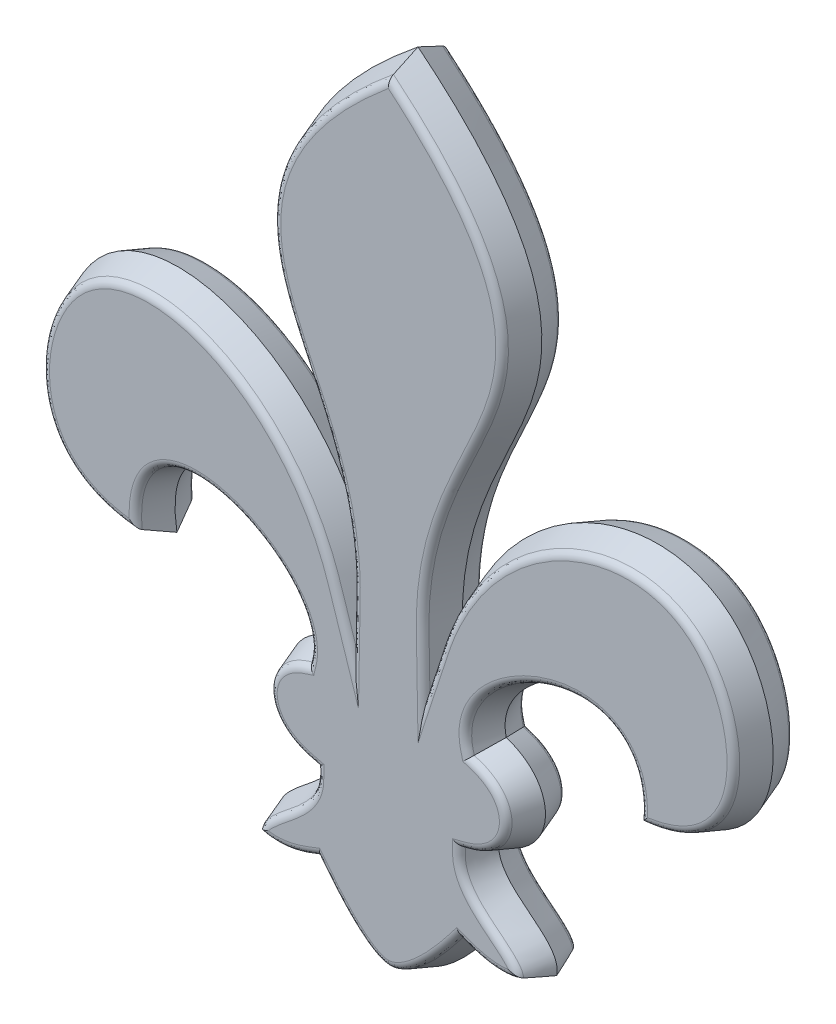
SolidWorks part; units mm, degrees
ref_plane "Front Plane" through (0, 0, 0) normal (0, 0, 1) x (1, 0, 0)
ref_plane "Top Plane" through (0, 0, 0) normal (0, 1, 0) x (1, 0, 0)
ref_plane "Right Plane" through (0, 0, 0) normal (1, 0, 0) x (0, 0, -1)
sketch "Picture" plane through (0, 0, 0) normal (0, 0, 1) x (1, 0, 0)
  line L0 (-0.0772, 107.11) -> (-0.0772, -92.89) construction
  dimension "D1" = 200
sketch "Sketch2" plane through (0, 0, 0) normal (0, 0, 1) x (1, 0, 0)
  line L0 (0, 107) -> (0, -93) construction
  line L1 (11.4926, -93) -> (-11.4926, -93) construction
  spline S0 degree 3 poles (0, 107) (-26.705, 85.4272) (-41.2591, 45.0445) (-10.6785, 17.0286) (-11.2094, -13.0596) knots 0 0 0 0 0.423015 1 1 1 1
  spline S1 degree 3 poles (-11.2094, -13.0596) (-23.7614, 25.2783) (-93.2492, 50.4886) (-94.9491, -28.5114) (-60.8422, -29.5265) knots 0 0 0 0 0.58333 1 1 1 1
  spline S2 degree 3 poles (-60.8422, -29.5265) (-66.5753, 5.7704) (-17.7554, -14.383) (-22.2767, -32.8004) knots 0 0 0 0 1 1 1 1
  spline S3 degree 3 poles (-22.2767, -32.8004) (-36.1792, -37.3243) (-35.3327, -53.5744) (-20.3666, -57.3969) knots 0 0 0 0 1 1 1 1
  spline S4 degree 3 poles (-20.3666, -57.3969) (-20.4076, -66.6377) (-36.7277, -70.4375) (-34.991, -78.4945) knots 0 0 0 0 1 1 1 1
  spline S5 degree 3 poles (-34.991, -78.4945) (-30.2325, -80.959) (-24.2208, -80.1612) (-18.6883, -78.015) knots 0 0 0 0 1 1 1 1
  spline S6 degree 2 poles (-18.6883, -78.015) (-7.0774, -93) (0, -93) knots 0 0 0 1 1 1
  spline S7 degree 2 poles (18.6883, -78.015) (7.0774, -93) (0, -93) knots 0 0 0 1 1 1
  spline S8 degree 3 poles (34.991, -78.4945) (30.2325, -80.959) (24.2208, -80.1612) (18.6883, -78.015) knots 0 0 0 0 1 1 1 1
  spline S9 degree 3 poles (20.3666, -57.3969) (20.4076, -66.6377) (36.7277, -70.4375) (34.991, -78.4945) knots 0 0 0 0 1 1 1 1
  spline S10 degree 3 poles (22.2767, -32.8004) (36.1792, -37.3243) (35.3327, -53.5744) (20.3666, -57.3969) knots 0 0 0 0 1 1 1 1
  spline S11 degree 3 poles (60.8422, -29.5265) (66.5753, 5.7704) (17.7554, -14.383) (22.2767, -32.8004) knots 0 0 0 0 1 1 1 1
  spline S12 degree 3 poles (11.2094, -13.0596) (23.7614, 25.2783) (93.2492, 50.4886) (94.9491, -28.5114) (60.8422, -29.5265) knots 0 0 0 0 0.58333 1 1 1 1
  spline S13 degree 3 poles (0, 107) (26.705, 85.4272) (41.2591, 45.0445) (10.6785, 17.0286) (11.2094, -13.0596) knots 0 0 0 0 0.423015 1 1 1 1
  dimension "D1" = 200
  dimension "D2" = 107
extrude "Boss-Extrude1" add sketch "Sketch2" along normal mid plane 15 draft 20
fillet "Fillet3" radius 2 54 edges at (-78.7027, 18.5593, -7.5) (-48.306, -7.3964, -7.5) (-29.4161, -45.2814, -7.5) (9.9876, -21.1781, -3.75) (62.4245, -28.0883, -3.7485) (21.1322, -33.8633, -3.75) (18.997, -56.338, -3.75) (33.4178, -77.3525, -4.6773) (18.2329, -76.3744, -3.75) (-18.2329, -76.3744, -3.75) (-33.4178, -77.3525, -4.6773) (-18.997, -56.338, -3.75) (-21.1322, -33.8633, -3.75) (-27.2903, -71.0457, -7.5) (-62.4245, -28.0883, -3.7485) (-9.9876, -21.1781, -3.75) (0, 105.2403, -3.7517) (-27.4595, -77.2675, -7.5) (-7.3027, -86.4606, -7.5) (6.3997, -87.2066, -7.5) (26.0202, -77.1424, -7.5) (9.9876, -21.1781, 3.75) (0, 105.2403, 3.7517) (-9.9876, -21.1781, 3.75) (-62.4245, -28.0883, 3.7485) (-21.1322, -33.8633, 3.75) (27.7621, -71.4297, -7.5) (-18.997, -56.338, 3.75) (-33.4178, -77.3525, 4.6773) (-18.2329, -76.3744, 3.75) (18.2329, -76.3744, 3.75) (33.4178, -77.3525, 4.6773) (18.997, -56.338, 3.75) (21.1322, -33.8633, 3.75) (62.4245, -28.0883, 3.7485) (26.3227, 45.586, 7.5) (-28.3324, 62.1938, 7.5) (-78.7027, 18.5593, 7.5) (29.4377, -44.3553, -7.5) (-48.306, -7.3964, 7.5) (-29.4161, -45.2814, 7.5) (-27.2903, -71.0457, 7.5) (26.3227, 45.586, -7.5) (-27.4595, -77.2675, 7.5) (-7.3027, -86.4606, 7.5) (6.3997, -87.2066, 7.5) (26.0202, -77.1424, 7.5) (27.7621, -71.4297, 7.5) (29.4377, -44.3553, 7.5) (47.2538, -7.423, 7.5) (79.0008, 18.2398, 7.5) (47.2538, -7.423, -7.5) (79.0008, 18.2398, -7.5) (-28.3324, 62.1938, -7.5)
